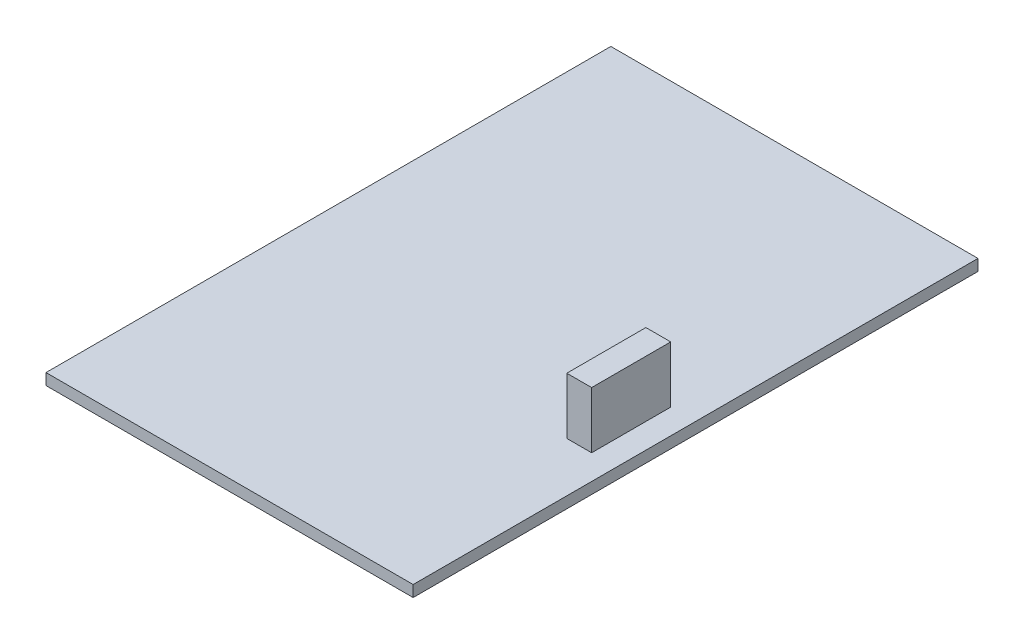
SolidWorks part; units mm, degrees
ref_plane "Piano frontale" through (0, 0, 0) normal (0, 0, 1) x (1, 0, 0)
ref_plane "Piano superiore" through (0, 0, 0) normal (0, 1, 0) x (1, 0, 0)
ref_plane "Piano destro" through (0, 0, 0) normal (1, 0, 0) x (0, 0, -1)
sketch "Schizzo1" plane through (0, 0, 0) normal (0, 1, 0) x (1, 0, 0)
  line L1 (0, 0) -> (325, 0)
  line L2 (0, 0) -> (0, 500)
  line L3 (0, 500) -> (325, 500)
  line L4 (325, 0) -> (325, 500)
  dimension "D1" = 500
  dimension "D2" = 325
extrude "Estrusione-Estrusione1" add sketch "Schizzo1" along normal blind 10
sketch "Schizzo2" plane through (0, 10, 0) normal (0, 1, 0) x (1, 0, 0)
  line L0 (0, 500) -> (0, 0) construction
  line L1 (303, 250) -> (281, 250)
  line L2 (303, 250) -> (303, 180)
  line L3 (303, 180) -> (281, 180)
  line L4 (281, 250) -> (281, 180)
  line L5 (0, 0) -> (325, 0) construction
  dimension "D1" = 70
  dimension "D2" = 22
  dimension "D3" = 303
  dimension "D4" = 250
extrude "Estrusione-Estrusione2" add sketch "Schizzo2" along normal blind 50
